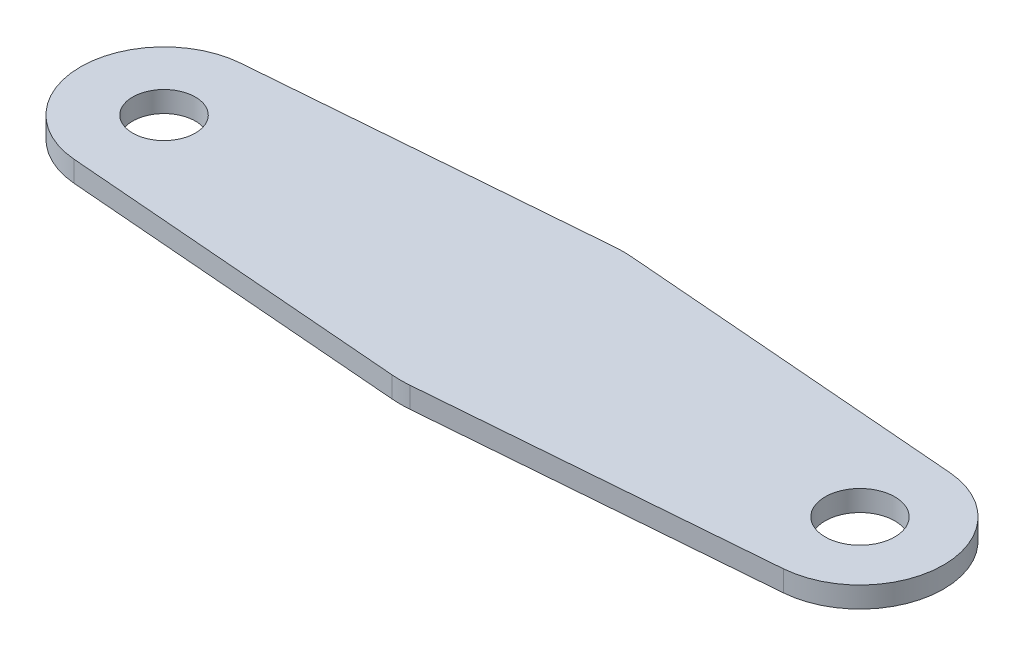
SolidWorks part; units mm, degrees
ref_plane "Front" through (0, 0, 0) normal (0, 0, 1) x (1, 0, 0)
ref_plane "Top" through (0, 0, 0) normal (0, 1, 0) x (1, 0, 0)
ref_plane "Right" through (0, 0, 0) normal (1, 0, 0) x (0, 0, -1)
sketch "Sketch1" plane through (0, 0, 0) normal (0, 1, 0) x (1, 0, 0)
  line L1 (-25.48, 5.9808) -> (-0.64, 7.9744)
  line L2 (0.64, -7.9744) -> (25.48, -5.9808)
  line L3 (0.64, 7.9744) -> (25.48, 5.9808)
  line L4 (-25.48, -5.9808) -> (-0.64, -7.9744)
  arc A0 (0.64, 7.9744) -> (-0.64, 7.9744) centre (0, 0) ccw
  circle A1 centre (25, 0) radius 2.5
  circle A2 centre (-25, 0) radius 2.25
  arc A3 (-25.48, 5.9808) -> (-25.48, -5.9808) centre (-25, 0) ccw
  arc A4 (25.48, -5.9808) -> (25.48, 5.9808) centre (25, 0) ccw
  arc A5 (-0.64, -7.9744) -> (0.64, -7.9744) centre (0, 0) ccw
extrude "Extrude1" add sketch "Sketch1" along normal blind 1.5
